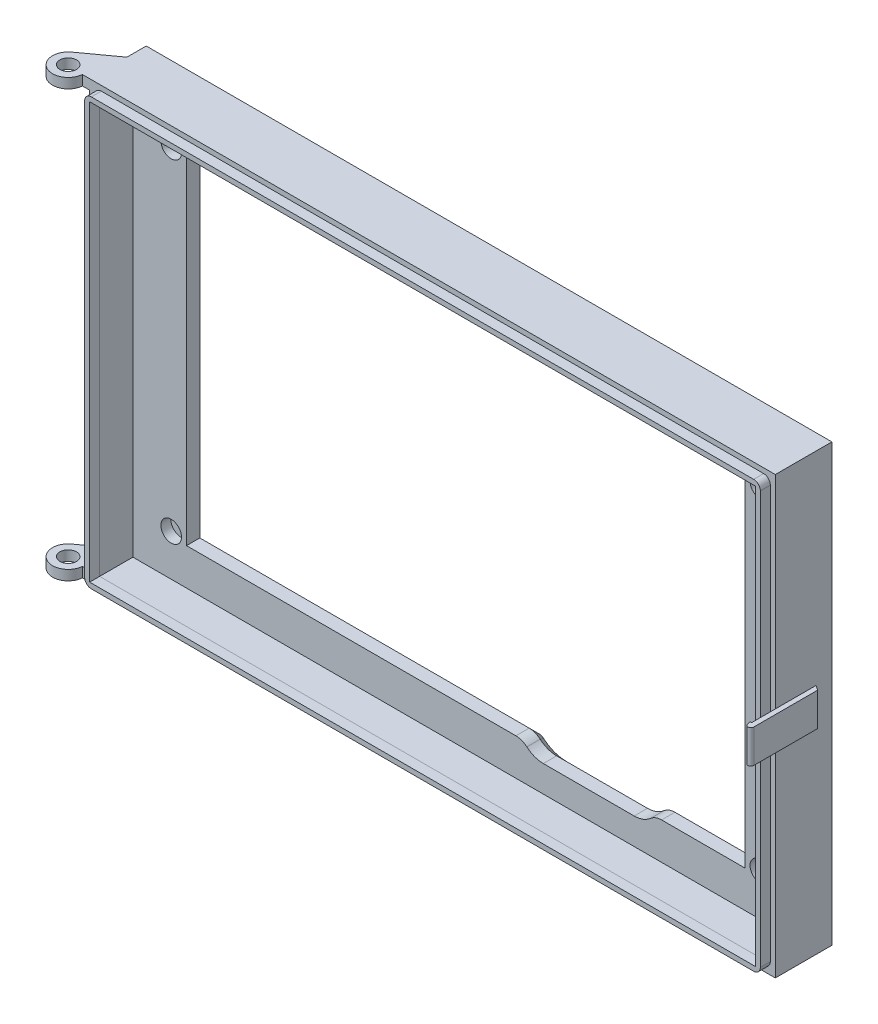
SolidWorks part; units mm, degrees
ref_plane "Front Plane" through (0, 0, 0) normal (0, 0, 1) x (1, 0, 0)
ref_plane "Top Plane" through (0, 0, 0) normal (0, 1, 0) x (1, 0, 0)
ref_plane "Right Plane" through (0, 0, 0) normal (1, 0, 0) x (0, 0, -1)
sketch "Sketch1" plane through (0, 0, 0) normal (0, 0, 1) x (1, 0, 0)
  line L0 (-84.2105, 0) -> (121.7895, 0)
  line L1 (-84.2105, 0) -> (-84.2105, 131)
  line L2 (121.7895, 0) -> (121.7895, 131)
  line L3 (-84.2105, 131) -> (121.7895, 131)
  dimension "D1" = 206
  dimension "D2" = 131
extrude "Boss-Extrude1" add sketch "Sketch1" along normal blind 7
sketch "Sketch2" plane through (0, 0, 7) normal (0, 0, 1) x (1, 0, 0)
  line L0 (-65.1105, 116.95) -> (102.6895, 116.95)
  line L1 (-65.1105, 116.95) -> (-65.1105, 14.05)
  line L2 (102.6895, 116.95) -> (102.6895, 14.05)
  line L3 (-65.1105, 14.05) -> (36.0158, 14.05)
  line L4 (-84.2105, 131) -> (-84.2105, 0) construction
  line L5 (121.7895, 131) -> (-84.2105, 131) construction
  line L6 (42.0895, 10.95) -> (69.3895, 10.95)
  line L7 (75.4632, 14.05) -> (102.6895, 14.05)
  arc A0 (69.3895, 10.95) -> (75.4632, 14.05) centre (69.3895, 18.45) ccw
  arc A1 (42.0895, 10.95) -> (36.0158, 14.05) centre (42.0895, 18.45) cw
  point P6 (-84.2105, 65.5)
  point P7 (-65.1105, 65.5)
  point P10 (18.7895, 131)
  point P11 (18.7895, 116.95)
  dimension "D5" = 7.5
  dimension "D1" = 167.8
  dimension "D2" = 102.9
  dimension "D3" = 3.1
  dimension "D4" = 33.3
  dimension "D6" = 60.6
extrude "Cut-Extrude1" cut sketch "Sketch2" against normal up to surface (7 mm away)
sketch "Sketch3" plane through (0, 0, 7) normal (0, 0, 1) x (1, 0, 0)
  line L0 (121.7895, 131) -> (-84.2105, 131) construction
  line L1 (-69.7105, 15.5) -> (107.2895, 15.5) construction
  line L2 (-69.7105, 15.5) -> (-69.7105, 115.5) construction
  line L3 (-69.7105, 115.5) -> (107.2895, 115.5) construction
  line L4 (107.2895, 15.5) -> (107.2895, 115.5) construction
  line L5 (-69.7105, 15.5) -> (107.2895, 115.5) construction
  line L6 (-69.7105, 115.5) -> (107.2895, 15.5) construction
  line L7 (-84.2105, 131) -> (-84.2105, 0) construction
  circle A0 centre (-69.7105, 115.5) radius 3.1
  circle A1 centre (-69.7105, 15.5) radius 3.1
  circle A2 centre (107.2895, 15.5) radius 3.1
  circle A3 centre (107.2895, 115.5) radius 3.1
  point P0 (18.7895, 65.5)
  point P12 (18.7895, 131)
  point P15 (-84.2105, 65.5)
  dimension "D1" = 6.2
  dimension "D2" = 100
  dimension "D3" = 177
extrude "Cut-Extrude3" cut sketch "Sketch3" against normal blind 3 contours A3 | A0 | A1 | A2
sketch "Sketch4" plane through (0, 0, 7) normal (0, 0, 1) x (1, 0, 0)
  line L0 (-84.2105, 0) -> (121.7895, 0) construction
  line L1 (-84.2105, 131) -> (121.7895, 131)
  line L2 (-84.2105, 131) -> (-84.2105, 0)
  line L3 (-84.2105, 0) -> (121.7895, 0)
  line L4 (121.7895, 131) -> (121.7895, 0)
  line L5 (-81.2105, 128) -> (118.7895, 128)
  line L6 (-81.2105, 128) -> (-81.2105, 3)
  line L7 (-81.2105, 3) -> (118.7895, 3)
  line L8 (118.7895, 128) -> (118.7895, 3)
  line L9 (121.7895, 0) -> (121.7895, 131) construction
  point P9 (-81.2105, 65.5)
  point P10 (-84.2105, 65.5)
  point P11 (18.7895, 131)
  point P12 (18.7895, 128)
  dimension "D1" = 3
  dimension "D2" = 3
extrude "Boss-Extrude2" add sketch "Sketch4" along normal blind 10
fillet "Fillet1" radius 5 2 edges at (36.0158, 14.05, 3.5) (75.4632, 14.05, 3.5)
chamfer "Chamfer1" distance 3 angle 45 10 edges at (-15.6303, 14.05, 0) (35.6106, 13.7297, 0) (39.4485, 11.4304, 0) (55.7395, 10.95, 0) (72.0305, 11.4304, 0) (75.8683, 13.7297, 0) (-65.1105, 65.5, 0) (90.1592, 14.05, 0) (102.6895, 65.5, 0) (18.7895, 116.95, 0)
sketch "Sketch5" plane through (0, 0, 0) normal (0, 0, 1) x (1, 0, 0)
  line L0 (-81.2105, 128) -> (118.7895, 128)
  line L1 (-82.7105, 129.5) -> (120.2895, 129.5)
  line L2 (-82.7105, 129.5) -> (-82.7105, 1.5)
  line L3 (-82.7105, 1.5) -> (120.2895, 1.5)
  line L4 (120.2895, 129.5) -> (120.2895, 1.5)
  line L5 (118.7895, 128) -> (118.7895, 3)
  line L6 (-81.2105, 3) -> (118.7895, 3)
  line L7 (-81.2105, 128) -> (-81.2105, 3)
  line L8 (121.7895, 0) -> (121.7895, 131) construction
  line L9 (121.7895, 131) -> (-84.2105, 131) construction
  line L10 (-84.2105, 131) -> (-84.2105, 0) construction
  line L11 (-84.2105, 0) -> (121.7895, 0) construction
  dimension "D2" = 1.5
  dimension "D3" = 1.5
  dimension "D4" = 1.5
  dimension "D5" = 1.5
extrude "Boss-Extrude3" add sketch "Sketch5" along normal blind 3 from surface at 17 separate body
fillet "Fillet2" radius 2 4 edges at (120.2895, 1.5, 18.5) (120.2895, 129.5, 18.5) (-82.7105, 1.5, 18.5) (-82.7105, 129.5, 18.5)
sketch "Sketch7" plane through (0, 131, 0) normal (0, 1, 0) x (1, 0, 0)
  line L0 (-84.2105, -17) -> (-84.2105, 0) construction
  line L1 (121.7895, 0) -> (-84.2105, 0) construction
  line L6 (-86.3906, -17) -> (-84.2105, -17)
  line L7 (-84.2105, -17) -> (-84.2105, -5.8064)
  line L8 (-84.2105, -5.8064) -> (-93.6714, -12.6702)
  circle A0 centre (-91.0724, -16.5863) radius 2.5
  arc A2 (-93.6714, -12.6702) -> (-86.3906, -17) centre (-91.0724, -16.5863) ccw
  dimension "D2" = 5
  dimension "D3" = 2.1801
  dimension "D4" = 9.4608
  dimension "D1" = 4.7
  dimension "D5" = 6.8618
  dimension "D6" = 5.8064
  dimension "D7" = 12.6702
extrude "Boss-Extrude5" add sketch "Sketch7" against normal blind 3
sketch "Sketch6" plane through (0, 0, 0) normal (0, 1, 0) x (1, 0, 0)
  line L0 (121.7895, -17) -> (-86.3906, -17) construction
  line L3 (-84.2105, -5.8064) -> (-93.6714, -12.6702) construction
  line L5 (-84.2105, -17) -> (-86.3906, -17)
  line L6 (-84.2105, -5.8064) -> (-93.6714, -12.6702)
  line L7 (-84.2105, -5.8064) -> (-84.2105, -17)
  circle A4 centre (-91.0724, -16.5863) radius 2.5 construction
  arc A5 (-93.6714, -12.6702) -> (-86.3906, -17) centre (-91.0724, -16.5863) ccw construction
  circle A6 centre (-91.0724, -16.5863) radius 2.5
  arc A7 (-93.6714, -12.6702) -> (-86.3906, -17) centre (-91.0724, -16.5863) ccw
sketch "Sketch8" plane through (0, 0, 0) normal (0, 1, 0) x (1, 0, 0)
  line L0 (121.7895, -4.7358) -> (123.2518, -5.7435)
  line L1 (121.7895, -17) -> (121.7895, 0) construction
  line L3 (121.7895, -17) -> (121.7895, -24.1353)
  line L6 (121.7895, -4.7358) -> (121.7895, -17)
  line L7 (121.7895, -17) -> (-86.3906, -17) construction
  line L11 (123.2518, -5.7435) -> (123.2476, -24.9178)
  line L12 (121.302, -24.2707) -> (121.6335, -25.394)
  line L13 (121.302, -24.2707) -> (121.3022, -24.1353)
  line L15 (121.3022, -24.1353) -> (121.7895, -24.1353)
  arc A3 (121.6335, -25.394) -> (123.2476, -24.9178) centre (122.3702, -24.9176) ccw
  dimension "D1" = 0.8774
  dimension "D2" = 121.302
  dimension "D3" = 7.1353
  dimension "D4" = 121.3022
  dimension "D5" = 121.6335
  dimension "D6" = 122.3702
  dimension "D7" = 123.2476
  dimension "D8" = 7.9178
  dimension "D9" = 123.2518
  dimension "D10" = 4.7358
  dimension "D11" = 24.2707
extrude "Boss-Extrude6" add sketch "Sketch8" along normal blind 10 from offset 60
extrude "Boss-Extrude7" add sketch "Sketch6" along normal blind 3
